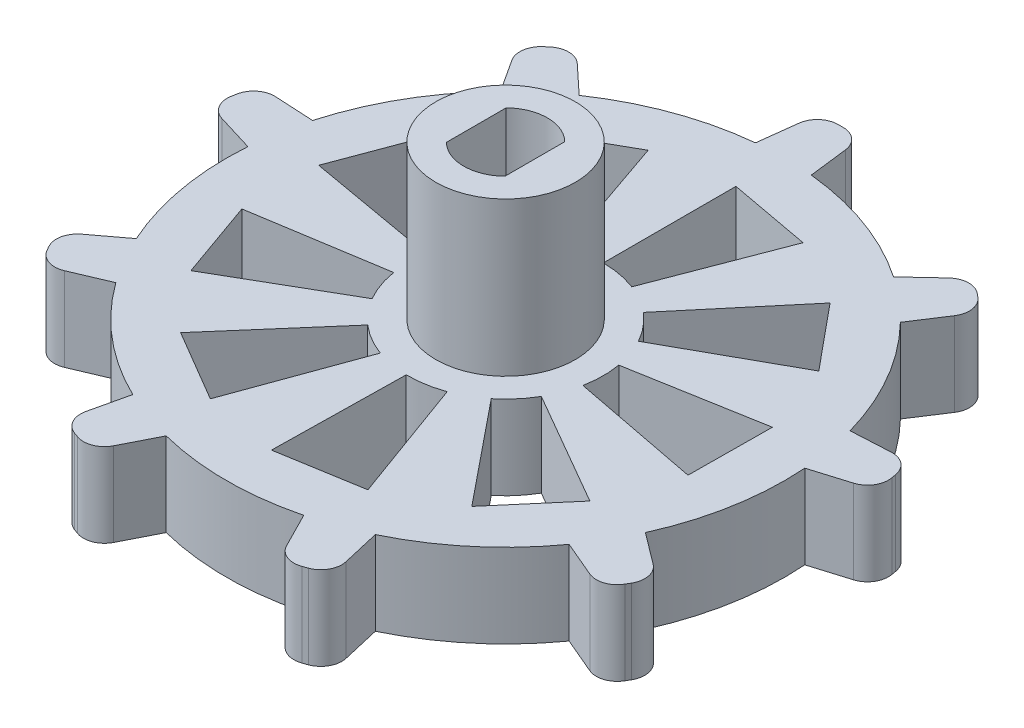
SolidWorks part; units mm, degrees
ref_plane "Plano frontal" through (0, 0, 0) normal (0, 0, 1) x (1, 0, 0)
ref_plane "Plano superior" through (0, 0, 0) normal (0, 1, 0) x (1, 0, 0)
ref_plane "Plano direito" through (0, 0, 0) normal (1, 0, 0) x (0, 0, -1)
sketch "Esboço1" plane through (0, 0, 0) normal (0, 1, 0) x (1, 0, 0)
  line L0 (-6.5221, 8.5943) -> (-6.5221, 18.0943)
  line L1 (-6.5221, 18.0943) -> (-0.6221, 17.0034)
  line L2 (-0.6221, 17.0034) -> (-4.0191, 8.1315)
  line L3 (-2.0226, 6.9566) -> (4.0839, 14.234)
  line L4 (7.9023, 9.6059) -> (-0.4026, 4.9931)
  line L5 (4.0839, 14.234) -> (7.9023, 9.6059)
  line L6 (0.3716, 2.8098) -> (9.7272, 4.4595)
  line L7 (9.6774, -1.5403) -> (0.3504, 0.2645)
  line L8 (9.7272, 4.4595) -> (9.6774, -1.5403)
  line L9 (-0.4599, -1.9057) -> (7.7673, -6.6557)
  line L10 (3.8726, -11.2198) -> (-2.1122, -3.842)
  line L11 (7.7673, -6.6557) -> (3.8726, -11.2198)
  line L12 (-4.1279, -4.9836) -> (-0.8787, -13.9106)
  line L13 (-6.796, -14.9034) -> (-6.6383, -5.4047)
  line L14 (-0.8787, -13.9106) -> (-6.796, -14.9034)
  line L15 (-8.9162, -4.9836) -> (-12.1654, -13.9106)
  line L16 (-17.3365, -10.8676) -> (-11.11, -3.6926)
  line L17 (-12.1654, -13.9106) -> (-17.3365, -10.8676)
  line L18 (-12.5843, -1.9057) -> (-20.8115, -6.6557)
  line L19 (-22.8167, -1.0007) -> (-13.435, 0.4934)
  line L20 (-20.8115, -6.6557) -> (-22.8167, -1.0007)
  line L21 (-13.4157, 2.8098) -> (-22.7714, 4.4595)
  line L22 (-20.6726, 10.0804) -> (-12.5253, 5.1945)
  line L23 (-22.7714, 4.4595) -> (-20.6726, 10.0804)
  line L24 (-11.0216, 6.9566) -> (-17.1281, 14.234)
  line L25 (-11.9072, 17.1908) -> (-8.8067, 8.211)
  line L26 (-17.1281, 14.234) -> (-11.9072, 17.1908)
  line L27 (-8.0221, 25.5943) -> (-5.0221, 25.5943)
  line L28 (-4.5343, 21.5943) -> (-4.5221, 21.5943)
  line L29 (-8.5099, 21.5943) -> (-8.5221, 21.5943)
  line L30 (-6.5221, 25.5943) -> (-5.0221, 25.5943)
  line L31 (-6.5221, 25.5943) -> (-8.0221, 25.5943)
  line L32 (-8.0221, 25.5943) -> (-8.5221, 21.494)
  line L33 (-5.0221, 25.5943) -> (-4.5221, 21.494)
  line L36 (7.7558, 20.9435) -> (4.7371, 18.124)
  line L37 (10.0539, 19.0152) -> (7.8013, 15.5528)
  line L38 (7.7558, 20.9435) -> (10.0539, 19.0152)
  line L40 (16.8528, 7.2391) -> (12.728, 7.0195)
  line L41 (17.3738, 4.2846) -> (13.4226, 3.0802)
  line L42 (16.8528, 7.2391) -> (17.3738, 4.2846)
  line L44 (15.0125, -9.1067) -> (11.7116, -6.6235)
  line L45 (13.5125, -11.7048) -> (9.7116, -10.0876)
  line L46 (15.0125, -9.1067) -> (13.5125, -11.7048)
  line L48 (3.0959, -20.4453) -> (2.1634, -16.4213)
  line L49 (0.2769, -21.4714) -> (-1.5954, -17.7894)
  line L50 (3.0959, -20.4453) -> (0.2769, -21.4714)
  line L52 (-13.321, -21.4714) -> (-11.4488, -17.7894)
  line L53 (-16.1401, -20.4453) -> (-15.2076, -16.4213)
  line L54 (-13.321, -21.4714) -> (-16.1401, -20.4453)
  line L56 (-26.5567, -11.7048) -> (-22.7558, -10.0876)
  line L57 (-28.0567, -9.1067) -> (-24.7558, -6.6235)
  line L58 (-26.5567, -11.7048) -> (-28.0567, -9.1067)
  line L60 (-30.4179, 4.2846) -> (-26.4668, 3.0802)
  line L61 (-29.897, 7.2391) -> (-25.7722, 7.0195)
  line L62 (-30.4179, 4.2846) -> (-29.897, 7.2391)
  line L64 (-23.0981, 19.0152) -> (-20.8455, 15.5528)
  line L65 (-20.7999, 20.9435) -> (-17.7813, 18.124)
  line L66 (-23.0981, 19.0152) -> (-20.7999, 20.9435)
  arc A0 (-8.5221, 21.494) -> (-17.7813, 18.124) centre (-6.5221, 1.5943) ccw
  circle A1 centre (-6.5221, 1.5943) radius 3
  arc A2 (-4.0191, 8.1315) -> (-6.5221, 8.5943) centre (-6.5221, 1.5943) ccw
  arc A3 (-0.4026, 4.9931) -> (-2.0226, 6.9566) centre (-6.5221, 1.5943) ccw
  arc A4 (0.3504, 0.2645) -> (0.3716, 2.8098) centre (-6.5221, 1.5943) ccw
  arc A5 (-2.1122, -3.842) -> (-0.4599, -1.9057) centre (-6.5221, 1.5943) ccw
  arc A6 (-6.6383, -5.4047) -> (-4.1279, -4.9836) centre (-6.5221, 1.5943) ccw
  arc A7 (-11.11, -3.6926) -> (-8.9162, -4.9836) centre (-6.5221, 1.5943) ccw
  arc A8 (-13.435, 0.4934) -> (-12.5843, -1.9057) centre (-6.5221, 1.5943) ccw
  arc A9 (-12.5253, 5.1945) -> (-13.4157, 2.8098) centre (-6.5221, 1.5943) ccw
  arc A10 (-8.8067, 8.211) -> (-11.0216, 6.9566) centre (-6.5221, 1.5943) ccw
  arc A11 (-20.8455, 15.5528) -> (-25.7722, 7.0195) centre (-6.5221, 1.5943) ccw
  arc A12 (-26.4668, 3.0802) -> (-24.7558, -6.6235) centre (-6.5221, 1.5943) ccw
  arc A13 (-22.7558, -10.0876) -> (-15.2076, -16.4213) centre (-6.5221, 1.5943) ccw
  arc A14 (-11.4488, -17.7894) -> (-1.5954, -17.7894) centre (-6.5221, 1.5943) ccw
  arc A15 (2.1634, -16.4213) -> (9.7116, -10.0876) centre (-6.5221, 1.5943) ccw
  arc A16 (11.7116, -6.6235) -> (13.4226, 3.0802) centre (-6.5221, 1.5943) ccw
  arc A17 (12.728, 7.0195) -> (7.8013, 15.5528) centre (-6.5221, 1.5943) ccw
  arc A18 (4.7371, 18.124) -> (-4.5221, 21.494) centre (-6.5221, 1.5943) ccw
  point P43 (-6.5221, 1.5943)
  point P85 (-6.5221, 1.5943)
  dimension "D1" = 40
  dimension "D2" = 6
  dimension "D3" = 14
  dimension "D4" = 9
  dimension "D6" = 9
  dimension "D5" = 6
  dimension "D9" = 1.5
  dimension "D10" = 1.5
extrude "Ressalto-extrusão1" add sketch "Esboço1" along normal blind 6 contours L36 A18 L33 L27 L32 A0 L65 L66 L64 A11 L61 L62 L60 A12 L57 L58 L56 A13 L53 L54 L52 A14 L49 L50 L48 A15 L45 L46 L44 A16 L41 L42 L40 A17 L37 L38 L25 A10 L24 L26 L19 A8 L18 L20 L13
sketch "Esboço2" plane through (0, 6, 0) normal (0, 1, 0) x (1, 0, 0)
  line L0 (-8.6221, 1.5943) -> (-8.6221, 3.7367)
  line L1 (-8.6221, 3.7367) -> (-8.6221, -0.5481)
  line L2 (-4.4221, 1.5943) -> (-4.4221, -0.5481)
  line L3 (-4.4221, -0.5481) -> (-4.4221, 3.7367)
  arc A1 (-8.6221, -0.5481) -> (-4.4221, -0.5481) centre (-6.5221, 1.5943) ccw
  circle A2 centre (-6.5221, 1.5943) radius 5
  arc A3 (-4.4221, 3.7367) -> (-8.6221, 3.7367) centre (-6.5221, 1.5943) ccw
  point P0 (-4.4221, 1.5943)
  point P1 (-6.5221, 1.5943)
  point P5 (-8.6221, 1.5943)
  dimension "D1" = 2.1
  dimension "D3" = 10
  dimension "D2" = 2.1
extrude "Ressalto-extrusão3" add sketch "Esboço2" along normal blind 11 contours L1 A1 L3 A3 | A2
fillet "Filete1" radius 1.5 1 edges at (-13.321, 3, 21.4714)
fillet "Filete2" radius 1.5 1 edges at (-16.1401, 3, 20.4453)
fillet "Filete3" radius 1.5 1 edges at (-26.5567, 3, 11.7048)
fillet "Filete4" radius 1.5 1 edges at (-28.0567, 3, 9.1067)
fillet "Filete5" radius 1.5 1 edges at (0.2769, 3, 21.4714)
fillet "Filete6" radius 1.5 1 edges at (3.0959, 3, 20.4453)
fillet "Filete7" radius 1.5 1 edges at (13.5125, 3, 11.7048)
fillet "Filete8" radius 1.5 1 edges at (15.0125, 3, 9.1067)
fillet "Filete9" radius 1.5 1 edges at (17.3738, 3, -4.2846)
fillet "Filete10" radius 1.5 1 edges at (16.8528, 3, -7.2391)
fillet "Filete11" radius 1.5 1 edges at (10.0539, 3, -19.0152)
fillet "Filete12" radius 1.5 1 edges at (7.7558, 3, -20.9435)
fillet "Filete13" radius 1.5 1 edges at (-5.0221, 3, -25.5943)
fillet "Filete14" radius 1.5 1 edges at (-8.0221, 3, -25.5943)
fillet "Filete15" radius 1.5 1 edges at (-20.7999, 3, -20.9435)
fillet "Filete16" radius 1.5 1 edges at (-23.0981, 3, -19.0152)
fillet "Filete17" radius 1.5 1 edges at (-29.897, 3, -7.2391)
fillet "Filete18" radius 1.5 1 edges at (-30.4179, 3, -4.2846)
